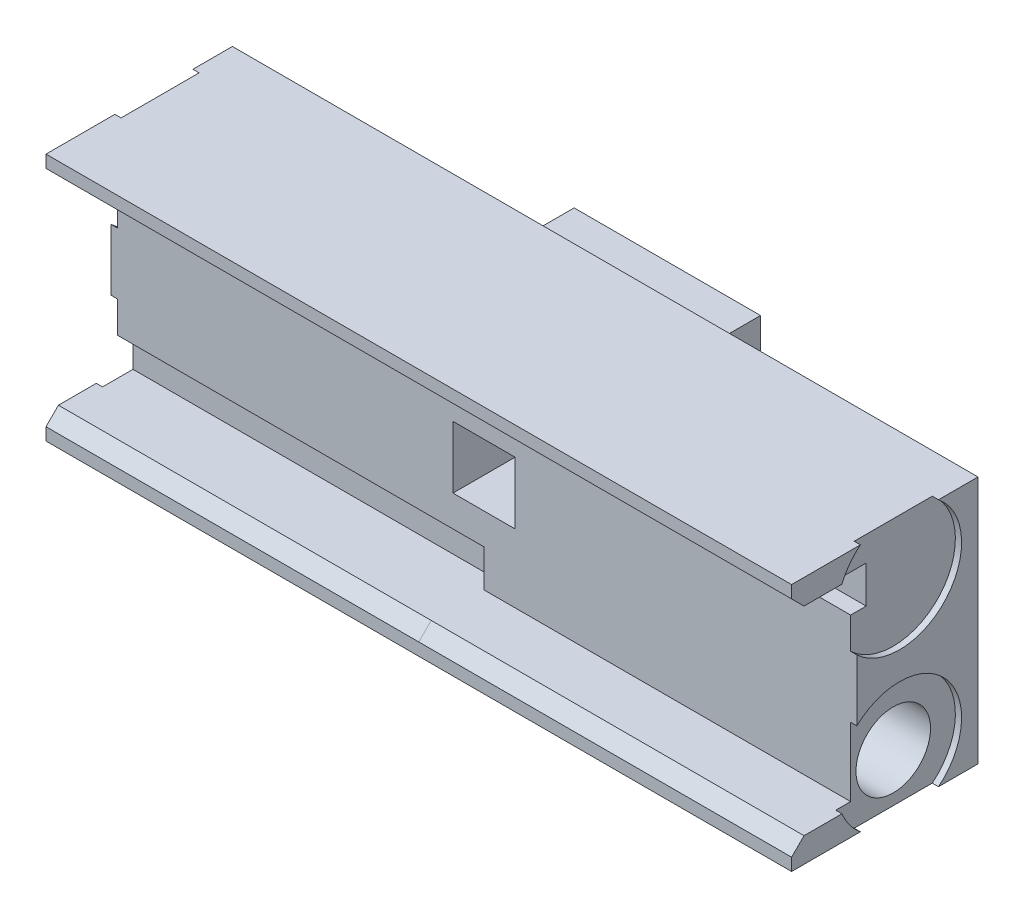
SolidWorks part; units mm, degrees
ref_plane "Płaszczyzna przednia" through (0, 0, 0) normal (0, 0, 1) x (1, 0, 0)
ref_plane "Płaszczyzna górna" through (0, 0, 0) normal (0, 1, 0) x (1, 0, 0)
ref_plane "Płaszczyzna prawa" through (0, 0, 0) normal (1, 0, 0) x (0, 0, -1)
sketch "Szkic1" plane through (0, 0, 0) normal (0, 0, 1) x (1, 0, 0)
  line L1 (-60, 20) -> (60, 20)
  line L2 (-60, 20) -> (-60, -20)
  line L3 (-60, -20) -> (60, -20)
  line L4 (60, 20) -> (60, -20)
  line L5 (-60, 20) -> (60, -20) construction
  line L6 (-60, -20) -> (60, 20) construction
  point P0 (0, 0)
  dimension "D1" = 40
  dimension "D2" = 120
extrude "Dodanie-wyciągnięcie1" add sketch "Szkic1" along normal blind 30
sketch "Szkic2" plane through (60, 0, 0) normal (1, 0, 0) x (0, 0, -1)
  line L0 (-19.5, -10) -> (-19.5, -16)
  line L1 (-30, -20) -> (-30, 20) construction
  line L2 (-30, 16) -> (-17, 16)
  line L3 (-17, 16) -> (-17, 10)
  line L4 (-17, 10) -> (-19.5, 10)
  line L5 (-19.5, 10) -> (-19.5, -10)
  line L6 (-30, 0) -> (-28.1713, 0) construction
  line L9 (-30, -16) -> (-19.5, -16)
  line L11 (-30, 16) -> (-30, -16)
  point P13 (-19.5, 0)
  dimension "D1" = 13
  dimension "D2" = 6
  dimension "D3" = 2.5
  dimension "D4" = 4
extrude "Wytnij-wyciągnięcie1" cut sketch "Szkic2" against normal blind 60
chamfer "Sfazowanie1" distance 2 angle 45 2 edges at (30, -16, 30) (30, 16, 30)
sketch "Szkic3" plane through (0, 0, 0) normal (0, 0, -1) x (-1, 0, 0)
  line L1 (-15, 15) -> (15, 15)
  line L2 (-15, 15) -> (-15, -15)
  line L3 (-15, -15) -> (15, -15)
  line L4 (15, 15) -> (15, -15)
  line L5 (-15, 15) -> (15, -15) construction
  line L6 (-15, -15) -> (15, 15) construction
  point P0 (0, 0)
  dimension "D1" = 30
  dimension "D2" = 30
extrude "Dodanie-wyciągnięcie2" add sketch "Szkic3" along normal blind 10
sketch "Szkic4" plane through (60, 0, 0) normal (1, 0, 0) x (0, 0, -1)
  line L0 (0, 0) -> (-8.3407, 0) construction
  line L1 (0, -20) -> (0, 20) construction
  circle A0 centre (-12.641, 12.2192) radius 10
  circle A1 centre (-12.641, -12.2192) radius 10
  dimension "D1" = 20
extrude "Wytnij-wyciągnięcie2" cut sketch "Szkic4" against normal blind 1
mirror "Lustro1" about plane through (0, 0, 0) normal (1, 0, 0) of "Wytnij-wyciągnięcie2"
sketch "Szkic5" plane through (0, 0, 19.5) normal (0, 0, 1) x (1, 0, 0)
  line L1 (-5, 5) -> (5, 5)
  line L2 (-5, 5) -> (-5, -5)
  line L3 (-5, -5) -> (5, -5)
  line L4 (5, 5) -> (5, -5)
  line L5 (-5, 5) -> (5, -5) construction
  line L6 (-5, -5) -> (5, 5) construction
  point P0 (0, 0)
  point P1 (0, 0)
  dimension "D1" = 10
  dimension "D2" = 10
extrude "Wytnij-wyciągnięcie3" cut sketch "Szkic5" against normal blind 10
sketch "Szkic8" plane through (-60, 0, 0) normal (-1, 0, 0) x (0, 0, 1)
  line L0 (30, -16) -> (17, -16)
  line L1 (30, 20) -> (30, -20) construction
  line L2 (17, -16) -> (17, -10)
  line L3 (17, -10) -> (19.5, -10)
  line L4 (19.5, -10) -> (19.5, 16)
  line L5 (19.5, 16) -> (30, 16)
  line L6 (30, 20) -> (18.9226, 20) construction
  line L7 (30, -20) -> (18.9226, -20) construction
  line L8 (30, 16) -> (30, -16)
  dimension "D1" = 4
  dimension "D3" = 4
  dimension "D4" = 13
  dimension "D5" = 6
  dimension "D6" = 2.5
extrude "Wytnij-wyciągnięcie4" cut sketch "Szkic8" against normal blind 60
chamfer "Sfazowanie2" distance 2 angle 45 2 edges at (-30, -16, 30) (-30, 16, 30)
sketch "Szkic9" plane through (59, 0, 0) normal (1, 0, 0) x (0, 0, -1)
  circle A0 centre (-12.641, -12.2192) radius 6
extrude "Wytnij-wyciągnięcie5" cut sketch "Szkic9" against normal blind 55
sketch "Szkic10" plane through (-59, 0, 0) normal (-1, 0, 0) x (0, 0, 1)
  circle A0 centre (12.641, 12.2192) radius 6
extrude "Wytnij-wyciągnięcie6" cut sketch "Szkic10" against normal blind 55
